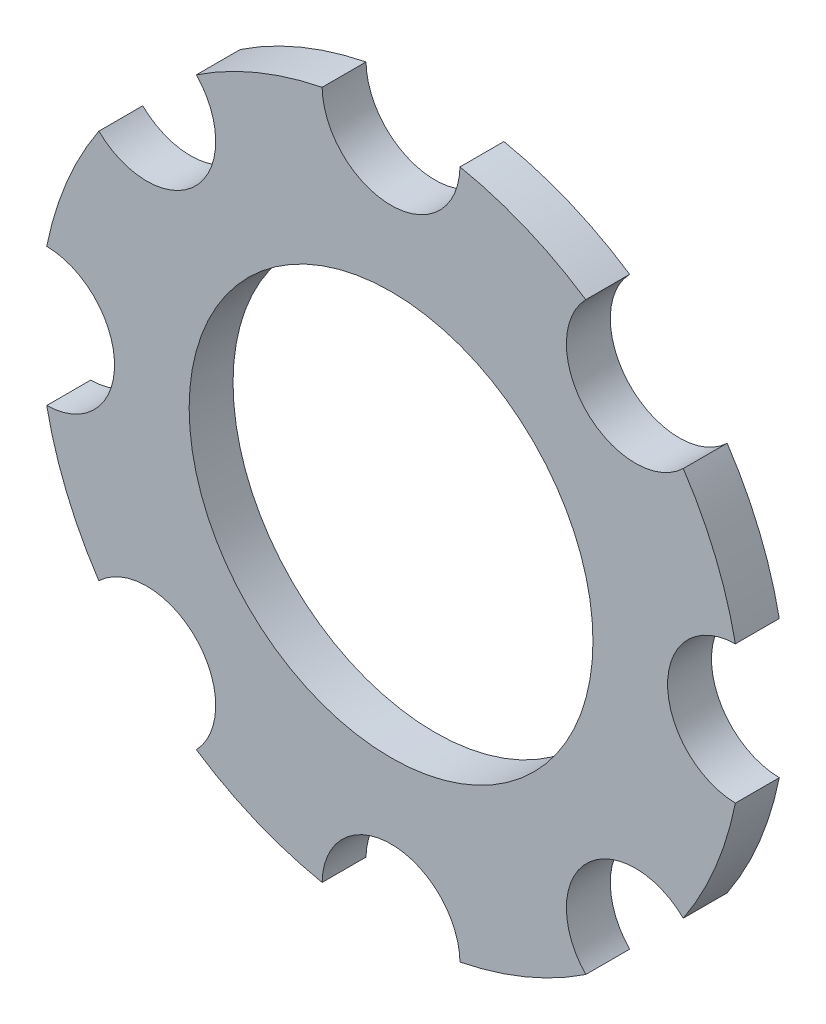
SolidWorks part; units mm, degrees
ref_plane "Front" through (0, 0, 0) normal (0, 0, 1) x (1, 0, 0)
ref_plane "Top" through (0, 0, 0) normal (0, 1, 0) x (1, 0, 0)
ref_plane "Right" through (0, 0, 0) normal (1, 0, 0) x (0, 0, -1)
sketch "Sketch1" plane through (0, 0, 0) normal (0, 0, 1) x (1, 0, 0)
  circle A0 centre (0, 0) radius 4
  circle A1 centre (0, 0) radius 2.3
  dimension "D0" = 8
  dimension "d" = 4.6
extrude "Base-Extrude" add sketch "Sketch1" against normal blind 0.5
sketch "Sketch2" plane through (-3.1363, -2.0725, 0) normal (0, 0, 1) x (1, 0, 0)
  line L0 (3.1363, 2.0725) -> (11.1363, 2.0725) construction
  line L1 (3.1363, 2.0725) -> (3.1363, 3.9121) construction
  line L2 (2.3509, 16.0079) -> (2.3509, 6.0079)
  line L3 (3.9217, 6.0079) -> (3.9217, 16.0079)
  line L4 (3.9217, 16.0079) -> (2.3509, 16.0079)
  circle A0 centre (3.1363, 2.0725) radius 3.15 construction
  circle A1 centre (3.1363, 2.0725) radius 4 construction
  arc A2 (3.9217, 6.0079) -> (2.3509, 6.0079) centre (3.1363, 6.0079) cw
  dimension "D2" = 6.3
  dimension "D1" = 8
  dimension "D3" = 1.5708
  dimension "D4" = 10
extrude "TypeASlot" cut sketch "Sketch2" against normal through all
pattern_circular "TypeAPattern" count 8 over 360 about axis through (0, 0, 0) along (0, 0, 1) of "TypeASlot"
equation "\"D2@Sketch2\" =  ( \"D0@Sketch1\" + \"d@Sketch1\" )  / 2"
equation "\"D3@Sketch2\" = \"D0@Sketch1\" * 3.14159 / \"D1@Sketch2\" / 2"
